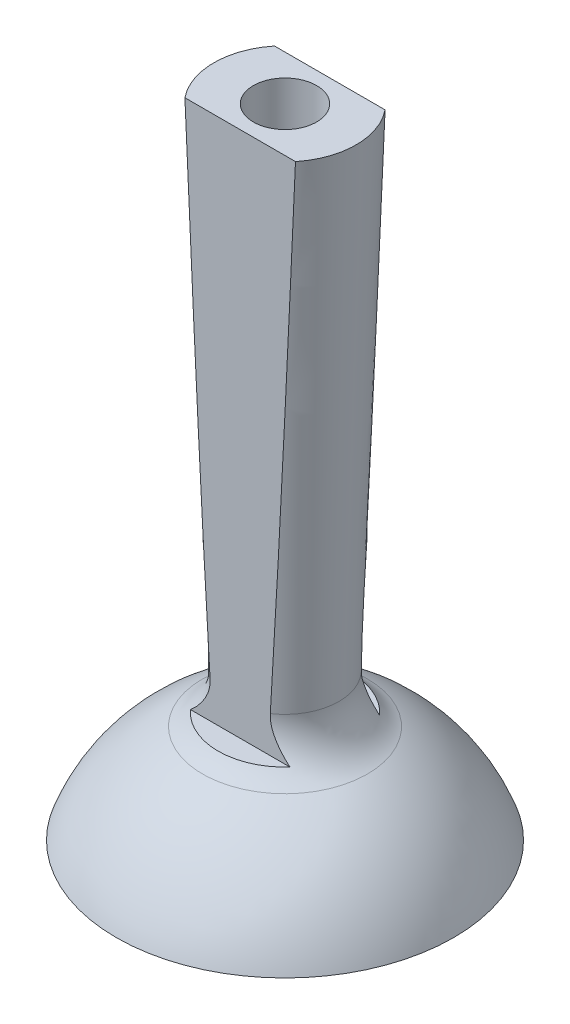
SolidWorks part; units mm, degrees
ref_plane "Спереди" through (0, 0, 0) normal (0, 0, 1) x (1, 0, 0)
ref_plane "Сверху" through (0, 0, 0) normal (0, 1, 0) x (1, 0, 0)
ref_plane "Справа" through (0, 0, 0) normal (1, 0, 0) x (0, 0, -1)
sketch "Эскиз1" plane through (0, 0, 0) normal (0, 0, 1) x (1, 0, 0)
  line L19 (-13.5, 90) -> (-10, -10)
  line L26 (-13.5, 90) -> (-6, 90)
  line L31 (-6, -8.9374) -> (-6, 90)
  line L32 (-32, -31) -> (-27, -31)
  line L33 (-6, -8.9374) -> (-6, -13.7874)
  line L34 (-27, -31) -> (-26.9845, -31)
  line L35 (0, 0) -> (0, 38.8635) construction
  line L36 (-26.9845, -31) -> (0, -31)
  line L37 (0, -31) -> (0, -28)
  line L38 (0, -28) -> (-6, -28)
  line L39 (-6, -28) -> (-6, -13.7874)
  arc A3 (-10, -10) -> (-32, -31) centre (0, -42.5) ccw
revolve "Повернуть1" add sketch "Эскиз1" angle 360 about L35
fillet "Скругление2" radius 10 1 edges at (0, -10, -10)
sketch "Эскиз2" plane through (0, 90, 0) normal (0, 1, 0) x (1, 0, 0)
  line L0 (0, 8.5) -> (19.6139, 8.5)
  line L1 (0, 0) -> (-21.4037, 0) construction
  line L2 (19.6139, 8.5) -> (19.6139, 16.0191)
  line L3 (19.6139, 16.0191) -> (-21.4037, 16.0191)
  line L4 (-21.4037, 16.0191) -> (-21.4037, 8.5)
  line L5 (-21.4037, 8.5) -> (0, 8.5)
  line L6 (-21.4037, -16.0191) -> (-21.4037, -8.5)
  line L7 (19.6139, -16.0191) -> (-21.4037, -16.0191)
  line L8 (19.6139, -8.5) -> (19.6139, -16.0191)
  line L9 (0, -8.5) -> (19.6139, -8.5)
  line L10 (-21.4037, -8.5) -> (0, -8.5)
extrude "Вырез-Вытянуть1" cut sketch "Эскиз2" against normal blind 100
